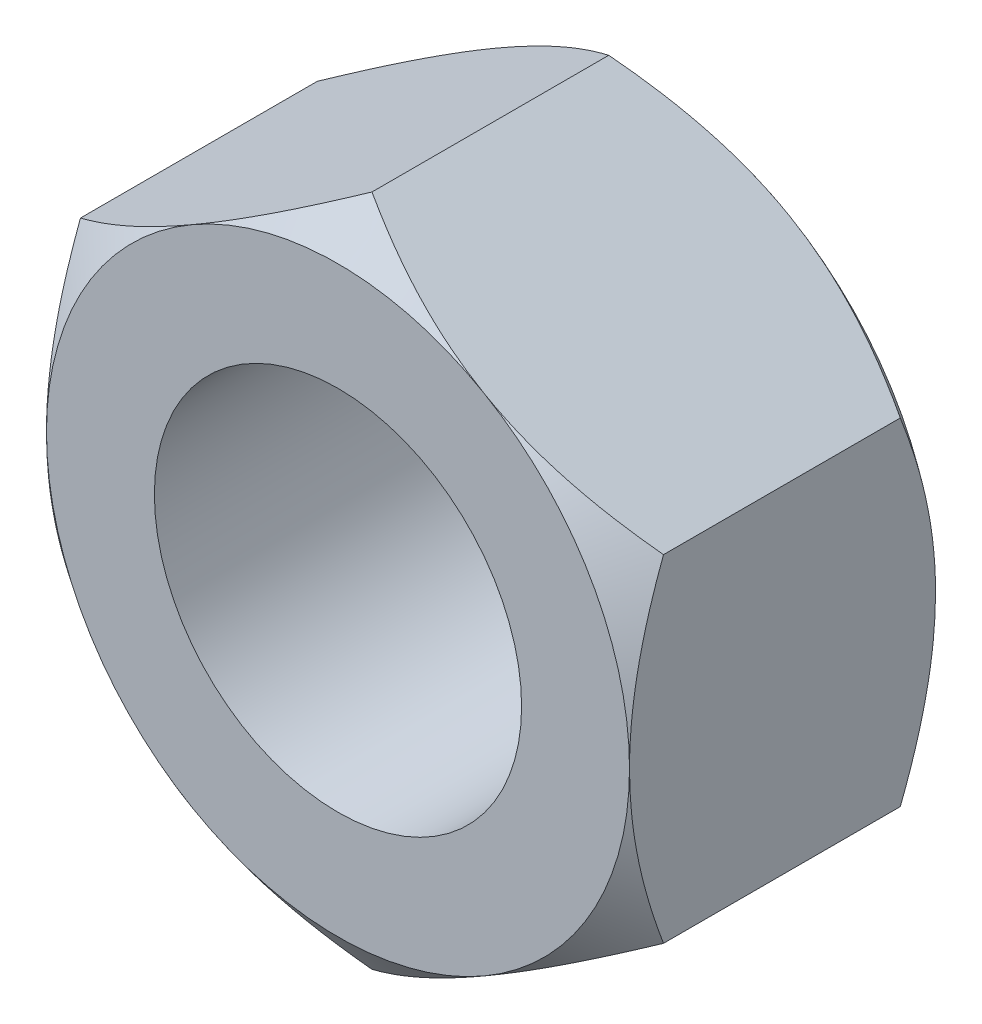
SolidWorks part; units mm, degrees
ref_plane "Face" through (0, 0, 0) normal (0, 0, 1) x (1, 0, 0)
ref_plane "Dessus" through (0, 0, 0) normal (0, 1, 0) x (1, 0, 0)
ref_plane "Droite" through (0, 0, 0) normal (1, 0, 0) x (0, 0, -1)
sketch "Esquisse1" plane through (0, 0, 0) normal (0, 0, 1) x (1, 0, 0)
  line L1 (-4.7631, -2.75) -> (0, -5.5)
  line L2 (0, -5.5) -> (4.7631, -2.75)
  line L3 (4.7631, -2.75) -> (4.7631, 2.75)
  line L4 (4.7631, 2.75) -> (0, 5.5)
  line L5 (0, 5.5) -> (-4.7631, 2.75)
  line L6 (-4.7631, 2.75) -> (-4.7631, -2.75)
  circle A0 centre (0, 0) radius 4.7631 construction
  dimension "D1" = 5.5
extrude "Extrusion1" add sketch "Esquisse1" against normal blind 5
sketch "Esquisse2" plane through (0, 0, 0) normal (0, 0, 1) x (1, 0, 0)
  circle A0 centre (0, 0) radius 3
  dimension "D1" = 6
extrude "Enlèv. mat.-Extru.1" cut sketch "Esquisse2" against normal blind 5
sketch "Esquisse3" plane through (0, 0, 0) normal (0, 0, 1) x (1, 0, 0)
  line L0 (4.7631, -2.75) -> (4.7631, 2.75) construction
  circle A0 centre (0, 0) radius 4.7631
  circle A1 centre (0, 0) radius 6.6519
extrude "Enlèv. mat.-Extru.2" cut sketch "Esquisse3" against normal blind 5 draft 53
sketch "Esquisse4" plane through (0, 0, -5) normal (0, 0, -1) x (-1, 0, 0)
  line L0 (0, 5.5) -> (4.7631, 2.75) construction
  circle A0 centre (0, 0) radius 4.7631
  circle A1 centre (0, 0) radius 6.5861
extrude "Enlèv. mat.-Extru.3" cut sketch "Esquisse4" against normal blind 5 draft 52
